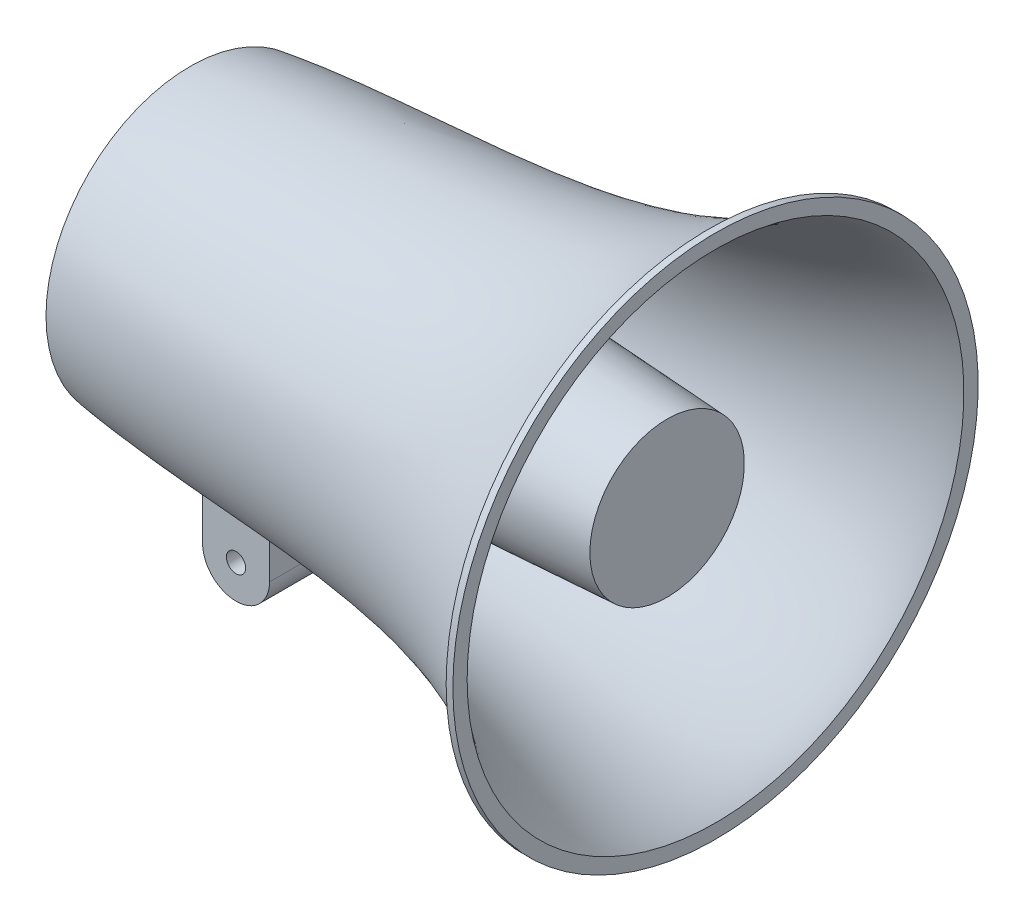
SolidWorks part; units mm, degrees
ref_plane "Front Plane" through (0, 0, 0) normal (0, 0, 1) x (1, 0, 0)
ref_plane "Top Plane" through (0, 0, 0) normal (0, 1, 0) x (1, 0, 0)
ref_plane "Right Plane" through (0, 0, 0) normal (1, 0, 0) x (0, 0, -1)
sketch "Sketch1" plane through (0, 0, 0) normal (0, 0, 1) x (1, 0, 0)
  line L0 (0, 0) -> (123.8619, 0) construction
  line L1 (0, 0) -> (0, 35.56)
  line L2 (127.882, 61.8875) -> (127.882, 64.77)
  line L3 (127.882, 64.77) -> (129.54, 64.77)
  line L4 (129.54, 64.77) -> (129.54, 61.252)
  line L5 (48.26, 38.6704) -> (48.26, 22.9681)
  line L6 (48.26, 22.9681) -> (117.602, 19.05)
  line L7 (117.602, 19.05) -> (117.602, 0)
  line L8 (0, 0) -> (117.602, 0)
  spline S0 degree 3 poles (0, 35.56) (42.3015, 41.7218) (90.8044, 35.8428) (127.882, 61.8875) knots 0 0 0 0 1 1 1 1
  spline S1 degree 3 poles (129.54, 61.252) (122.1088, 55.0341) (92.7597, 42.3505) (60.5792, 39.2621) (48.26, 38.6704) knots 0 0 0 0 0.47104 0.787254 0.787254 0.787254 0.787254
  dimension "D1" = 48.26
  dimension "D2" = 129.54
  dimension "D3" = 11.938
  dimension "D4" = 19.05
  dimension "D5" = 35.56
  dimension "D6" = 64.77
revolve "Revolve1" add sketch "Sketch1" angle 360 about L0
sketch "Sketch2" plane through (0, 0, 0) normal (0, 0, 1) x (1, 0, 0)
  line L0 (10.668, -57.15) -> (10.668, 0)
  line L1 (10.668, 0) -> (27.178, 0)
  line L2 (27.178, 0) -> (27.178, -57.15)
  line L3 (0, 35.56) -> (0, -35.56) construction
  arc A0 (10.668, -57.15) -> (27.178, -57.15) centre (18.923, -57.15) ccw
  circle A1 centre (18.923, -57.15) radius 2.3796
  dimension "D1" = 10.668
  dimension "D2" = 16.51
  dimension "D3" = 21.59
extrude "Boss-Extrude1" add sketch "Sketch2" along normal mid plane 15.24
